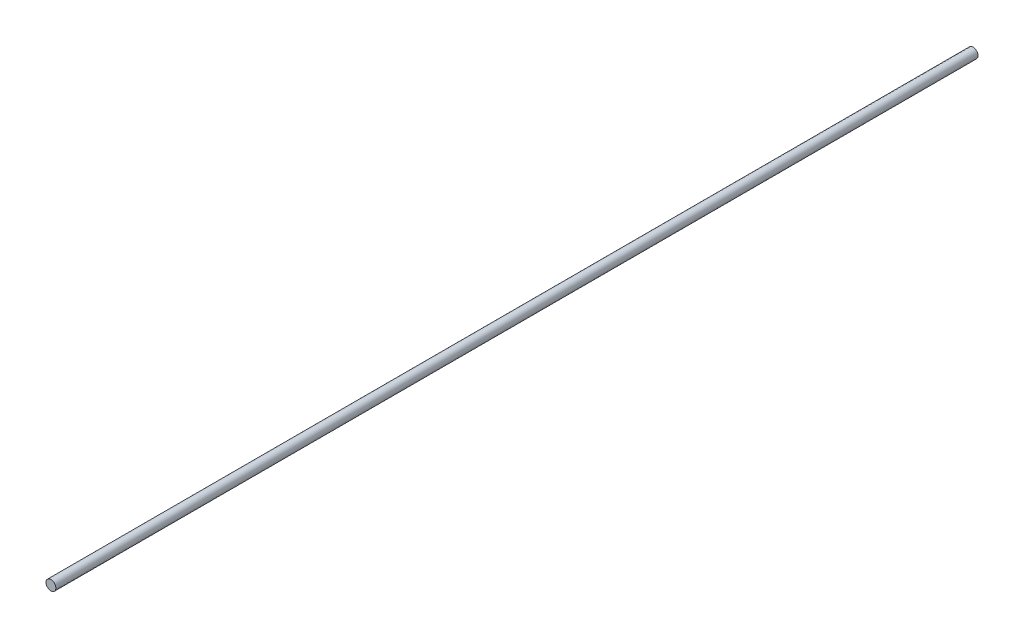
SolidWorks part; units mm, degrees
ref_plane "Front Plane" through (0, 0, 0) normal (0, 0, 1) x (1, 0, 0)
ref_plane "Top Plane" through (0, 0, 0) normal (0, 1, 0) x (1, 0, 0)
ref_plane "Right Plane" through (0, 0, 0) normal (1, 0, 0) x (0, 0, -1)
sketch "Sketch1" plane through (0, 0, 0) normal (0, 0, 1) x (1, 0, 0)
  circle A0 centre (0, 0) radius 30
  dimension "D1" = 60
extrude "Boss-Extrude1" add sketch "Sketch1" against normal blind 5600
